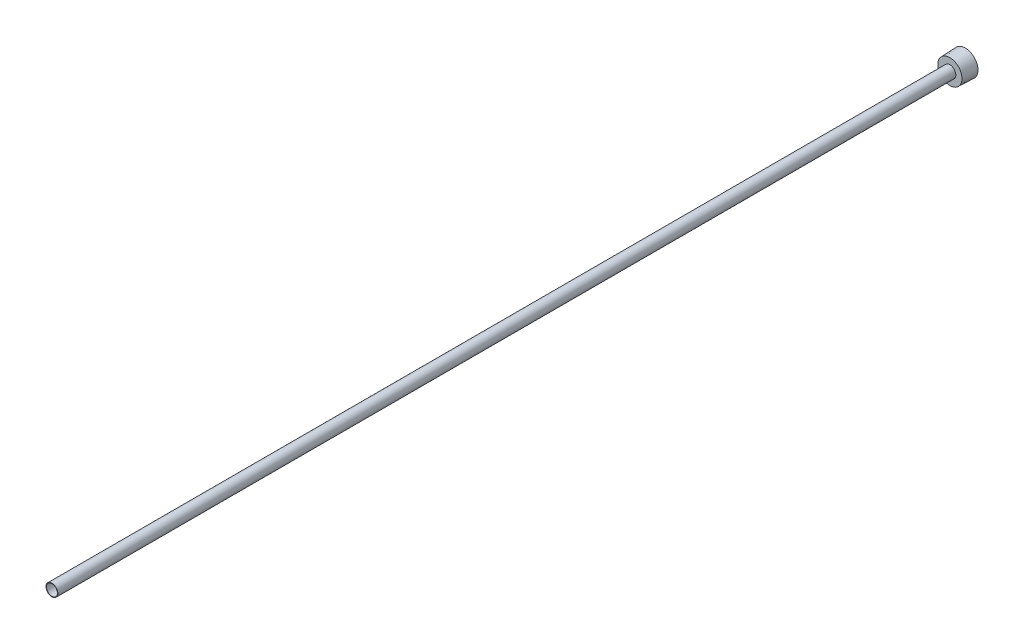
SolidWorks part; units mm, degrees
ref_plane "Front Plane" through (0, 0, 0) normal (0, 0, 1) x (1, 0, 0)
ref_plane "Top Plane" through (0, 0, 0) normal (0, 1, 0) x (1, 0, 0)
ref_plane "Right Plane" through (0, 0, 0) normal (1, 0, 0) x (0, 0, -1)
sketch "Sketch1" plane through (0, 0, 0) normal (1, 0, 0) x (0, 0, -1)
  line L0 (-168.7934, 0) -> (49831.2066, 0) construction
  line L6 (0, 0) -> (0, 8.4709)
  line L7 (0, 8.4709) -> (-10.3124, 8.0947)
  line L8 (-10.3124, 8.0947) -> (-10.3124, 3.9624)
  line L9 (-10.3124, 3.9624) -> (-609.6, 3.9624)
  line L10 (-609.6, 3.9624) -> (-609.6, 0)
  line L11 (0, 0) -> (-609.6, 0)
  dimension "D1" = 10.3124
  dimension "D2" = 16.9418
  dimension "D3" = 2.089
  dimension "D4" = 7.9248
  dimension "D5" = 609.6
revolve "Revolve1" add sketch "Sketch1" angle 360 about L0
sketch "Sketch2" plane through (0, 0, 609.6) normal (0, 0, 1) x (1, 0, 0)
  circle A0 centre (0, 0) radius 3.6576
  dimension "D1" = 7.3152
extrude "Cut-Extrude1" cut sketch "Sketch2" against normal through all
sketch "Sketch3" plane through (0, 0, 0) normal (0, 0, -1) x (-1, 0, 0)
  line L0 (0, 9.318) -> (0, -9.318) construction
  line L1 (-4.7625, -2.7496) -> (0, -5.4993)
  line L2 (0, -5.4993) -> (4.7625, -2.7496)
  line L3 (4.7625, -2.7496) -> (4.7625, 2.7496)
  line L4 (4.7625, 2.7496) -> (0, 5.4993)
  line L5 (0, 5.4993) -> (-4.7625, 2.7496)
  line L6 (-4.7625, 2.7496) -> (-4.7625, -2.7496)
  circle A0 centre (0, 0) radius 4.7625 construction
  dimension "D1" = 9.525
extrude "Cut-Extrude2" cut sketch "Sketch3" against normal blind 6.35
